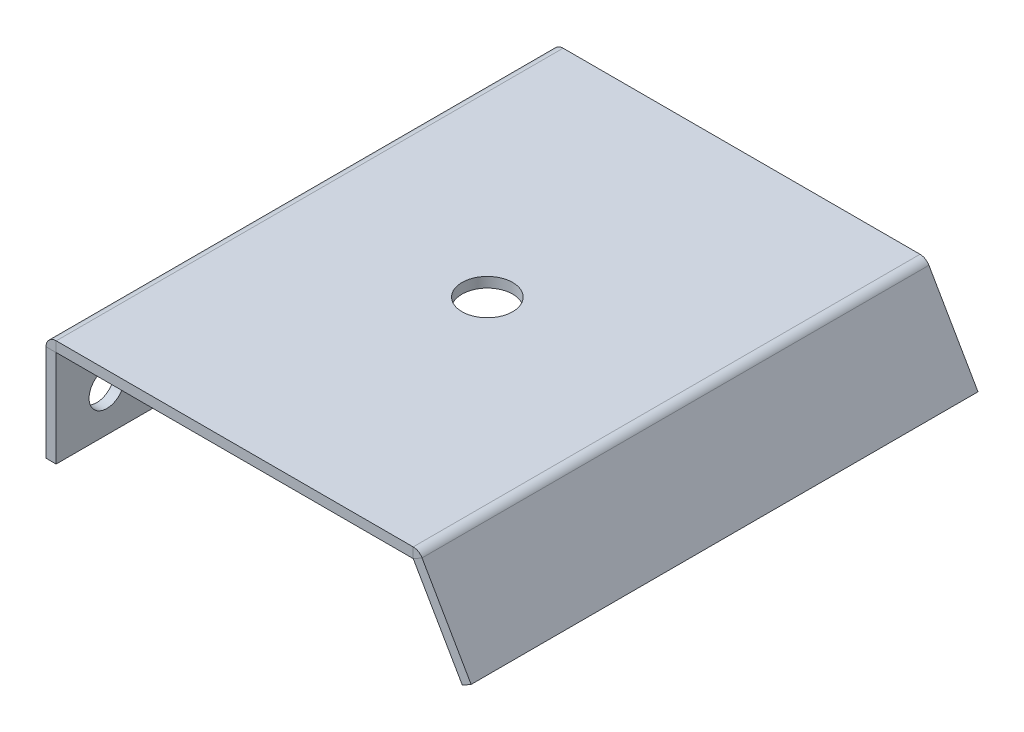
SolidWorks part; units mm, degrees
ref_plane "Front" through (0, 0, 0) normal (0, 0, 1) x (1, 0, 0)
ref_plane "Top" through (0, 0, 0) normal (0, 1, 0) x (1, 0, 0)
ref_plane "Right" through (0, 0, 0) normal (1, 0, 0) x (0, 0, -1)
sketch "Sketch1" plane through (0, 0, 0) normal (0, 1, 0) x (1, 0, 0)
  line L1 (0, 0) -> (56, 0)
  line L2 (0, 0) -> (0, 50)
  line L3 (0, 50) -> (56, 50)
  line L4 (56, 0) -> (56, 50)
  circle A0 centre (4, 45) radius 1.75
  circle A1 centre (4, 5) radius 1.75
  circle A2 centre (28, 25) radius 2.5
sheet metal parameters "Sheet-Metal1" thickness 1 parameters "D1"=0.01
base flange "Base-Flange1" sketch "Sketch1" thickness 1 reverse thickness direction yes parameters "D1"=0.01
sketch "Sketch3" plane through (0, 1, 0) normal (0, 1, 0) x (-1, 0, 0)
  line L1 (-46, -50) -> (-46, 0)
sketched bend "Sketched Bend1" parameters "D1"=0.01
bend "SketchBend1" bend radius 0.01 bend angle 60 parameters "D5"=1
sketch "Sketch4" plane through (0, 1, 0) normal (0, 1, 0) x (-1, 0, 0)
  line L1 (-10, -50) -> (-10, 0)
sketched bend "Sketched Bend2" parameters "D1"=0.01
bend "SketchBend2" bend radius 0.01 bend angle 90 parameters "D5"=2
flat pattern "Flat-Pattern1"
sketch "Bend-Lines1" plane through (0, 1, 0) normal (0, 1, 0) x (-1, 0, 0)
  line L0 (-10, -50) -> (-10, 0) construction
  line L1 (-46, -50) -> (-46, 0) construction
bend of the flat pattern "Flatten-<SketchBend1>1"
bend of the flat pattern "Flatten-<SketchBend2>1"
